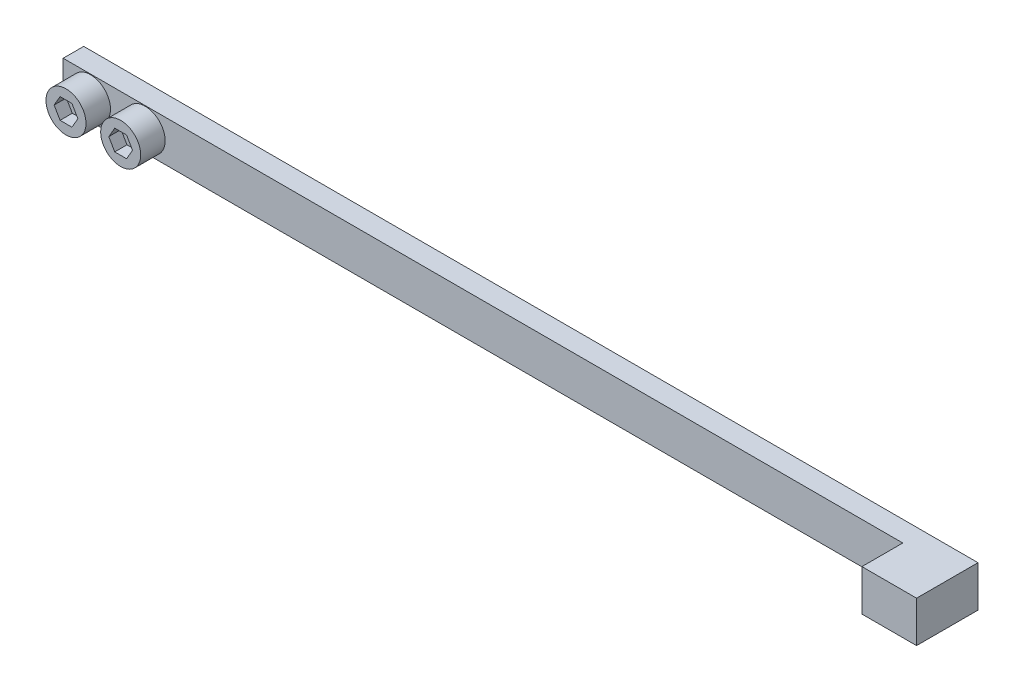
SolidWorks part; units mm, degrees
ref_plane "Front Plane" through (0, 0, 0) normal (0, 0, 1) x (1, 0, 0)
ref_plane "Top Plane" through (0, 0, 0) normal (0, 1, 0) x (1, 0, 0)
ref_plane "Right Plane" through (0, 0, 0) normal (1, 0, 0) x (0, 0, -1)
ref_plane "Plane1" through (-40.0812, 0, 0) normal (1, 0, 0) x (0, 0, -1)
ref_plane "Plane2" through (0, 0, -1.1938) normal (0, 0, 1) x (1, 0, 0)
ref_plane "Plane3" through (0, -2.3876, 0) normal (0, 1, 0) x (-1, 0, 0)
sketch "Sketch1" plane through (0, -2.3876, 0) normal (0, 1, 0) x (-1, 0, 0)
  line L0 (63.8048, -1.1938) -> (63.8048, 1.1938)
  line L1 (63.8048, 1.1938) -> (-33.7312, 1.1938)
  line L2 (-33.7312, 1.1938) -> (-33.7312, 5.9436)
  line L3 (-33.7312, 5.9436) -> (-40.0812, 5.9436)
  line L4 (-40.0812, 5.9436) -> (-40.0812, -1.1938)
  line L5 (-40.0812, -1.1938) -> (63.8048, -1.1938)
  dimension "D1" = 103.886
  dimension "D2" = 6.35
extrude "Extrude1" add sketch "Sketch1" along normal blind 4.7752
ref_plane "Plane4" through (0, 0, 1.1938) normal (0, 0, 1) x (1, 0, 0)
sketch "Sketch2" plane through (0, 0, 1.1938) normal (0, 0, 1) x (1, 0, 0)
  line L0 (-63.8048, 2.3876) -> (-63.8048, -2.3876) construction
  circle A0 centre (-60.6298, 0) radius 2.3241
  circle A1 centre (-54.2798, 0) radius 2.3241
  point P7 (-63.8048, 0)
  dimension "D3" = 4.6482
  dimension "D1" = 3.175
  dimension "D2" = 6.35
extrude "Extrude2" add sketch "Sketch2" along normal blind 2.8448
ref_plane "Plane5" through (0, 0, 4.0386) normal (0, 0, 1) x (1, 0, 0)
sketch "Sketch3" plane through (0, 0, 4.0386) normal (0, 0, 1) x (1, 0, 0)
  line L0 (-61.319, -1.1938) -> (-59.9406, -1.1938)
  line L1 (-59.9406, -1.1938) -> (-59.2513, 0)
  line L2 (-59.2513, 0) -> (-59.9406, 1.1938)
  line L3 (-59.9406, 1.1938) -> (-61.319, 1.1938)
  line L4 (-61.319, 1.1938) -> (-62.0083, 0)
  line L5 (-62.0083, 0) -> (-61.319, -1.1938)
  line L6 (-55.6583, 0) -> (-54.969, -1.1938)
  line L7 (-53.5906, 1.1938) -> (-54.969, 1.1938)
  line L8 (-52.9013, 0) -> (-53.5906, 1.1938)
  line L9 (-53.5906, -1.1938) -> (-52.9013, 0)
  line L10 (-54.969, 1.1938) -> (-55.6583, 0)
  line L11 (-54.969, -1.1938) -> (-53.5906, -1.1938)
  circle A0 centre (-60.6298, 0) radius 1.1938 construction
  circle A1 centre (-60.6298, 0) radius 2.3241 construction
  circle A2 centre (-54.2798, 0) radius 1.1938 construction
  circle A3 centre (-54.2798, 0) radius 2.3241 construction
  dimension "D1" = 2.3876
  dimension "D2" = 120
  dimension "D3" = 120
extrude "Cut-Extrude1" cut sketch "Sketch3" against normal blind 1.4224 contours L4 L5 L0 L1 L2 L3 | L6 L11 L9 L8 L7 L10
ref_plane "Plane6" through (-51.1048, 0, 0) normal (-1, 0, 0) x (0, 0, 1)
